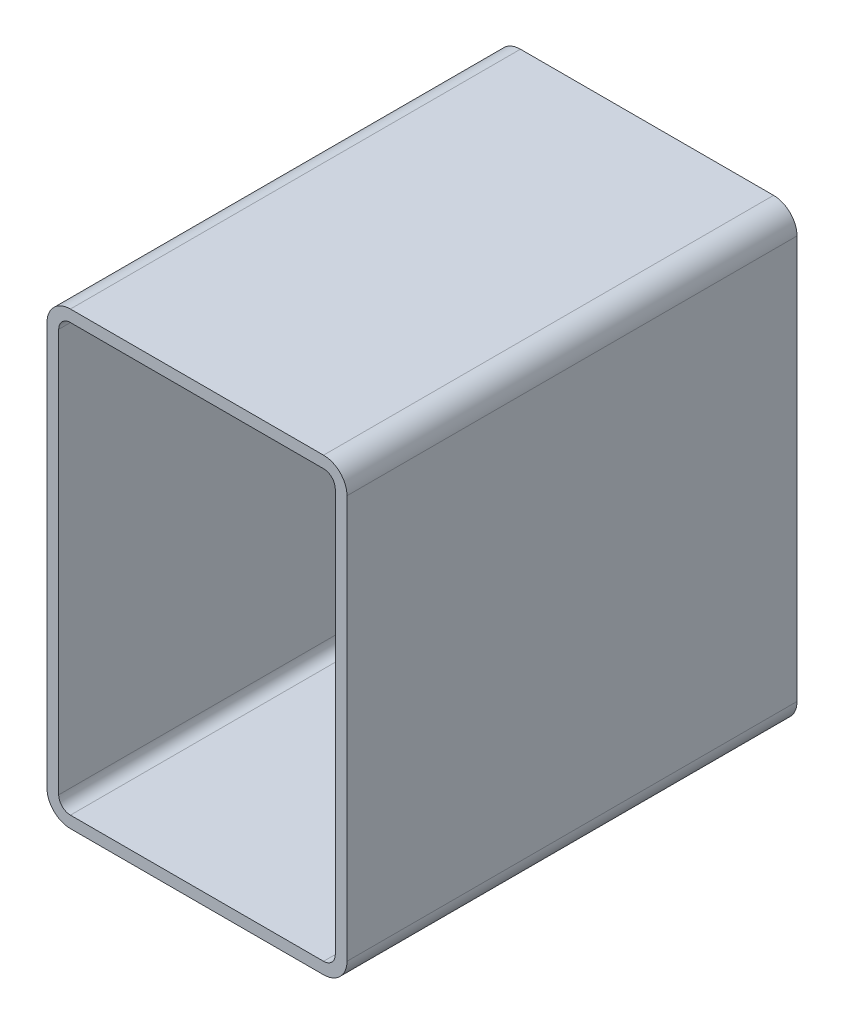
SolidWorks part; units mm, degrees
ref_plane "Front Plane" through (0, 0, 0) normal (0, 0, 1) x (1, 0, 0)
ref_plane "Top Plane" through (0, 0, 0) normal (0, 1, 0) x (1, 0, 0)
ref_plane "Right Plane" through (0, 0, 0) normal (1, 0, 0) x (0, 0, -1)
sketch "Sketch1" plane through (0, 0, 0) normal (0, 0, 1) x (1, 0, 0)
sketch_block_instance "HSS12x8x0.3125-1"
sketch_block "HSS12x8x0.3125"
extrude "Boss-Extrude1" add sketch "Sketch1" along normal blind 304.8
